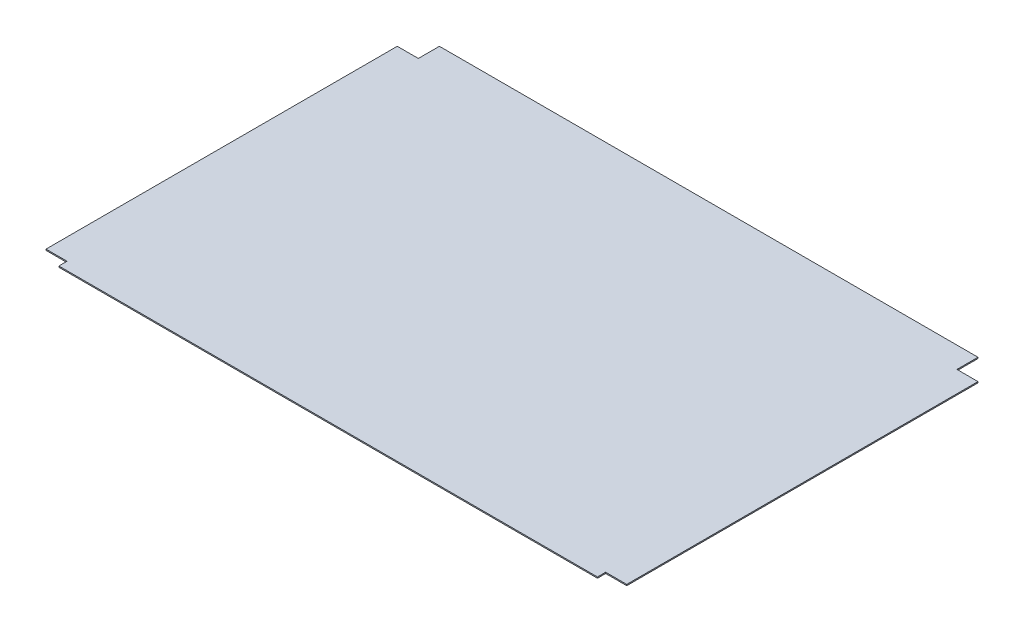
SolidWorks part; units mm, degrees
ref_plane "Front Plane" through (0, 0, 0) normal (0, 0, 1) x (1, 0, 0)
ref_plane "Top Plane" through (0, 0, 0) normal (0, 1, 0) x (1, 0, 0)
ref_plane "Right Plane" through (0, 0, 0) normal (1, 0, 0) x (0, 0, -1)
sketch "Sketch1" plane through (0, 0, 0) normal (0, 1, 0) x (1, 0, 0)
  line L1 (314.96, -213.36) -> (-314.96, -213.36)
  line L2 (314.96, -213.36) -> (314.96, 213.36)
  line L3 (314.96, 213.36) -> (-314.96, 213.36)
  line L4 (-314.96, -213.36) -> (-314.96, 213.36)
  line L5 (314.96, -213.36) -> (-314.96, 213.36) construction
  line L6 (314.96, 213.36) -> (-314.96, -213.36) construction
  point P0 (0, 0)
  dimension "D1" = 629.92
  dimension "D2" = 426.72
extrude "Extrude1" add sketch "Sketch1" along normal blind 1.27
sketch "Sketch2" plane through (0, 1.27, 0) normal (0, 1, 0) x (1, 0, 0)
  line L1 (-314.96, -213.36) -> (-292.1, -213.36)
  line L2 (-314.96, -213.36) -> (-314.96, -190.5)
  line L3 (-314.96, -190.5) -> (-292.1, -190.5)
  line L4 (-292.1, -213.36) -> (-292.1, -190.5)
  dimension "D1" = 22.86
extrude "Extrude2" cut sketch "Sketch2" against normal through all
mirror "Mirror1" about plane through (0, 0, 0) normal (1, 0, 0) of "Extrude2"
mirror "Mirror2" about plane through (0, 0, 0) normal (0, 0, 1) of "Mirror1", "Extrude2"
sketch "Sketch3" plane through (0, 0, 213.36) normal (0, 0, 1) x (1, 0, 0)
  line L4 (292.1, 0) -> (292.1, 1.27)
  line L5 (292.1, 1.27) -> (-292.1, 1.27)
  line L6 (-292.1, 1.27) -> (-292.1, 0)
  line L7 (-292.1, 0) -> (292.1, 0)
  line L8 (292.1, 0) -> (292.1, 1.27)
  line L9 (292.1, 1.27) -> (-292.1, 1.27)
  line L10 (-292.1, 1.27) -> (-292.1, 0)
  line L11 (-292.1, 0) -> (292.1, 0)
  dimension "D1" = 0
extrude "Extrude3" cut sketch "Sketch3" against normal blind 13.97
